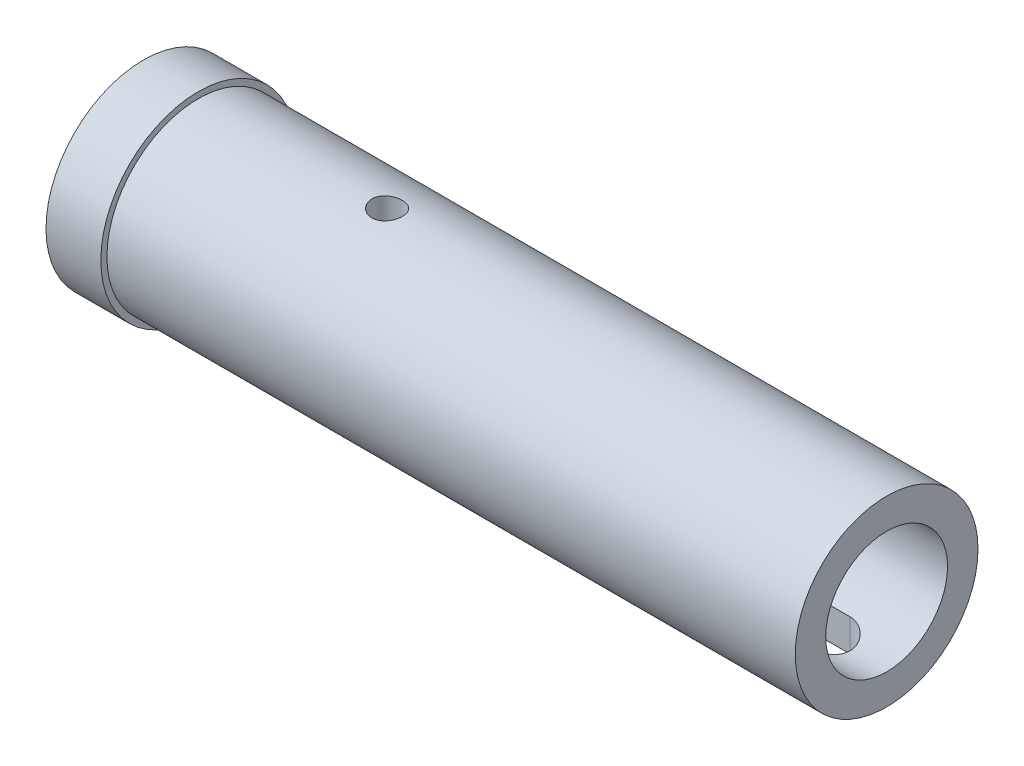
SolidWorks part; units mm, degrees
ref_plane "前视基准面" through (0, 0, 0) normal (0, 0, 1) x (1, 0, 0)
ref_plane "上视基准面" through (0, 0, 0) normal (0, 1, 0) x (1, 0, 0)
ref_plane "右视基准面" through (0, 0, 0) normal (1, 0, 0) x (0, 0, -1)
sketch "草图1" plane through (0, 0, 0) normal (0, 0, 1) x (1, 0, 0)
  line L0 (50, 0) -> (-72, 0)
  line L1 (-72, 0) -> (-72, 16)
  line L2 (-72, 16) -> (-63, 16)
  line L3 (-63, 16) -> (-63, 15)
  line L4 (-63, 15) -> (50, 15)
  line L5 (50, 15) -> (50, 0)
  dimension "D1" = 122
revolve "旋转1" add sketch "草图1" angle 360 about L0
ref_plane "基准面1" through (0, -15, 0) normal (0, 1, 0) x (-1, 0, 0)
sketch "草图2" plane through (0, -15, 0) normal (0, 1, 0) x (-1, 0, 0)
  line L3 (-40, -4) -> (-3, -4)
  line L4 (-3, 4) -> (-40, 4)
  arc A0 (-3, -4) -> (-3, 4) centre (-3, 0) ccw
  arc A1 (-40, 4) -> (-40, -4) centre (-40, 0) ccw
extrude "切除-拉伸1" cut sketch "草图2" along normal blind 10
sketch "草图3" plane through (-72, 0, 0) normal (-1, 0, 0) x (0, 0, 1)
  circle A0 centre (0, 0) radius 10
extrude "切除-拉伸2" cut sketch "草图3" against normal up to next
sketch "草图4" plane through (-72, 0, 0) normal (-1, 0, 0) x (0, 0, 1)
  point P0 (14, 0)
  point P1 (-14, 0)
  point P2 (0, 14)
  point P3 (0, -14)
hole_wizard "M3 螺纹孔1" positions "3D草图1" profile "草图5" tap size "M3" standard "GB"
sketch3d "3D草图1"
  point P0 (-72, 0, -14)
  point P3 (-72, 14, 0)
  point P6 (-72, 0, 14)
  point P9 (-72, -14, 0)
sketch "草图5" plane through (-72, 0, -14) normal (0, 1, 0) x (0, 0, 1)
  line L0 (0, 0) -> (0, 7.7511)
  line L1 (0, 7.7511) -> (1.25, 7)
  line L2 (1.25, 7) -> (1.25, 0)
  line L5 (1.25, 0) -> (0, 0)
  line L10 (0, 7.7511) -> (-1.25, 7) construction
  line L11 (0, -6.35) -> (0, 107.95) construction
  dimension "蹟恇謂郰芛眻噤" = 2.5
  dimension "蹟恇謂郰芛旮僅" = 7
  dimension "絳芛褒僅" = 118
sketch "草图6" plane through (-72, 0, 0) normal (-1, 0, 0) x (0, 0, 1)
  circle A0 centre (0, 0) radius 11
extrude "切除-拉伸3" cut sketch "草图6" against normal blind 12
sketch "草图7" plane through (0, 0, 0) normal (0, 1, 0) x (1, 0, 0)
  line L1 (50, -10) -> (50, 10) construction
  circle A0 centre (-32, 0) radius 2.5
  dimension "D1" = 82
extrude "切除-拉伸4" cut sketch "草图7" along normal up to next
